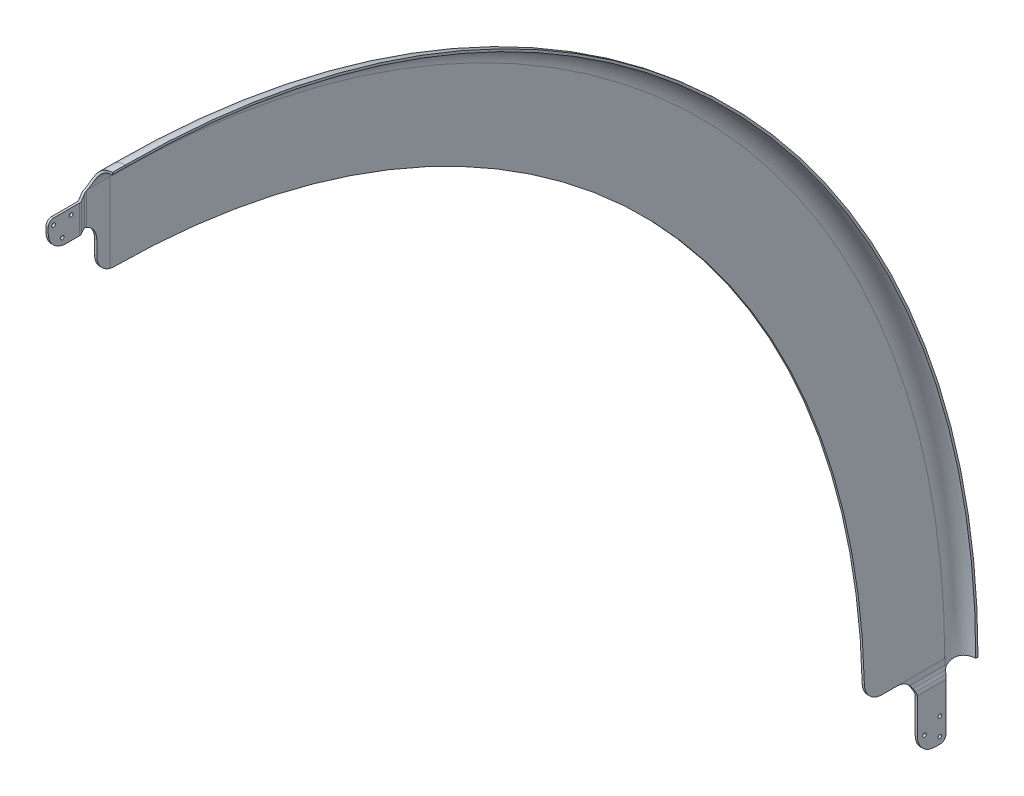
SolidWorks part; units mm, degrees
ref_plane "Front Plane" through (0, 0, 0) normal (1, 0, 0) x (0, 1, 0)
ref_plane "Top Plane" through (0, 0, 0) normal (0, 0, 1) x (0, 1, 0)
ref_plane "Right Plane" through (0, 0, 0) normal (0, 1, 0) x (-1, 0, 0)
sketch "sk 47.8in radi" plane through (0, 0, 0) normal (1, 0, 0) x (0, 1, 0)
  line B0 (-844.7111, -650.1) -> (-379.5689, -650.1)
  line B1 (-844.7111, -648.5125) -> (-379.5689, -648.5125)
  line B2 (844.7111, 574.18) -> (844.7111, 650.1)
  line B3 (843.1236, 574.18) -> (843.1236, 650.1)
  line B4 (843.1236, 650.1) -> (844.7111, 650.1)
  line B5 (-844.7111, -648.5125) -> (-844.7111, -650.1)
  arc B6 (-379.5689, -650.1) -> (844.7111, 574.18) centre (-379.5689, 574.18) ccw
  arc B7 (-379.5689, -648.5125) -> (843.1236, 574.18) centre (-379.5689, 574.18) ccw
  dimension "D1" = 650.1
  dimension "D2" = 844.7111
sketch_block_instance "Block1-1"
sketch_block "Block1" parameters "D1"=1224.28, "D2"=1222.6925, "D4"=1215.2, "D5"=1213.6125, "D3"=1.5875, "D6"=85, "D7"=474.2222
sketch "Curve Path" plane through (0, 0, 0) normal (1, 0, 0) x (0, 1, 0)
  line L0 (-844.7111, -648.5125) -> (-379.5689, -648.5125)
  line L1 (843.1236, 574.18) -> (843.1236, 650.1)
  arc A0 (843.1236, 574.18) -> (-379.5689, -648.5125) centre (-379.5689, 574.18) cw
  arc A1 (-379.5689, -648.5125) -> (843.1236, 574.18) centre (-379.5689, 574.18) ccw construction
ref_plane "Plane Body" through (0, -844.7111, 0) normal (0, 1, 0) x (-1, 0, 0)
sketch "Sketch5"
sketch_block_instance "Block3-3"
sketch_block "Block3" parameters "D1"=25.4, "D2"=16.51, "D3"=61.595, "D4"=243.65
sketch "Body" plane through (0, -844.7111, 0) normal (0, 1, 0) x (-1, 0, 0)
  line L0 (0, -648.5125) -> (92.71, -648.5125) construction
  line L1 (118.11, -623.1125) -> (118.11, -423.9125)
  line L2 (14.605, -398.5125) -> (92.71, -398.5125)
  line L3 (0, -645.3375) -> (92.71, -645.3375) construction
  line L4 (114.935, -623.1125) -> (114.935, -423.9125)
  line L5 (14.605, -401.6875) -> (92.71, -401.6875)
  line L6 (0, -645.3375) -> (0, -648.5125) construction
  line L7 (14.605, -398.5125) -> (14.605, -401.6875)
  line L8 (92.71, -645.3375) -> (92.71, -648.5125)
  arc A0 (118.11, -423.9125) -> (92.71, -398.5125) centre (92.71, -423.9125) ccw
  arc A1 (118.11, -423.9125) -> (92.71, -398.5125) centre (92.71, -423.9125) ccw construction
  arc A2 (92.71, -648.5125) -> (118.11, -623.1125) centre (92.71, -623.1125) ccw
  arc A3 (92.71, -648.5125) -> (118.11, -623.1125) centre (92.71, -623.1125) ccw construction
  arc A4 (92.71, -645.3375) -> (114.935, -623.1125) centre (92.71, -623.1125) ccw
  arc A5 (114.935, -423.9125) -> (92.71, -401.6875) centre (92.71, -423.9125) ccw
  dimension "D1" = 3.175
sweep "Sweep1" add profiles "Body" path "Curve Path"
sketch "Sketch37" plane through (0, 0, 0) normal (1, 0, 0) x (0, 1, 0)
  line L0 (-389.5689, -579.1125) -> (-379.5689, -579.1125)
  line L5 (-379.5689, -579.1125) -> (-379.5689, -340.9051)
  line L7 (-905.0426, -340.9051) -> (-379.5689, -340.9051)
  line L8 (-905.0426, -340.9051) -> (-905.0426, -672.2266)
  line L9 (-905.0426, -672.2266) -> (-379.5689, -672.2266)
  line L10 (-389.5689, -579.1125) -> (-389.5689, -619.9375)
  line L11 (-389.5689, -619.9375) -> (-379.5689, -619.9375)
  line L12 (-379.5689, -619.9375) -> (-379.5689, -672.2266)
  line L13 (-844.7111, -623.1125) -> (-379.5689, -623.1125) construction
  line L14 (-379.5689, -423.9125) -> (-379.5689, -623.1125) construction
  dimension "D2" = 3.175
  dimension "D1" = 10
  dimension "D3" = 40.825
extrude "Cut-Extrude8" cut sketch "Sketch37" against normal through all
sketch "Sketch38" [suppressed] plane through (0, 0, 0) normal (1, 0, 0) x (0, 1, 0)
  line L0 (618.5236, 650.1) -> (817.7236, 650.1) construction
  line L1 (817.7236, 662.9685) -> (879.2961, 662.9685)
  line L2 (817.7236, 662.9685) -> (817.7236, 615.35)
  line L3 (839.7236, 593.35) -> (879.2961, 593.35)
  line L4 (879.2961, 662.9685) -> (879.2961, 593.35)
  line L5 (817.7236, 574.18) -> (817.7236, 650.1) construction
  arc A0 (817.7236, 615.35) -> (839.7236, 593.35) centre (839.7236, 615.35) ccw
  dimension "D2" = 22
  dimension "D1" = 56.75
extrude "Cut-Extrude9" [suppressed] cut sketch "Sketch38" against normal through all
sketch "Sketch39" plane through (0, 0, 0) normal (1, 0, 0) x (0, 1, 0)
  line L9 (-379.5689, -508.1125) -> (-883.7788, -508.1125)
  line L11 (-883.7788, 574.18) -> (-883.7788, -508.1125)
  line L12 (702.7236, 574.18) -> (702.7236, 801.8703)
  line L13 (702.7236, 801.8703) -> (-883.7788, 574.18)
  arc A3 (-379.5689, -423.9125) -> (618.5236, 574.18) centre (-379.5689, 574.18) ccw construction
  arc A8 (-379.5689, -623.1125) -> (817.7236, 574.18) centre (-379.5689, 574.18) ccw construction
  arc A9 (-379.5689, -623.1125) -> (817.7236, 574.18) centre (-379.5689, 574.18) ccw construction
  arc A10 (-379.5689, -508.1125) -> (702.7236, 574.18) centre (-379.5689, 574.18) ccw
  point P5 (326.1891, -131.578)
  point P13 (0, 0)
  point P17 (0, 0)
  point P18 (0, 0)
  point P20 (0, 0)
  point P21 (0, 0)
  point P22 (0, 0)
  point P23 (0, 0)
  point P24 (-379.5689, -508.1125)
  point P25 (0, 0)
  point P26 (0, 0)
  point P29 (-379.5689, -508.1125)
  point P30 (0, 0)
  point P31 (0, 0)
  point P32 (0, 0)
  point P33 (0, 0)
  point P36 (0, 0)
  dimension "D1" = 115
extrude "Cut-Extrude10" cut sketch "Sketch39" against normal through all
sketch "Sketch40" plane through (0, 0, -579.1125) normal (0, 0, 1) x (1, 0, 0)
  line L0 (-118.11, -387.5689) -> (-118.11, -388.8894)
  line L1 (-116.7703, -393.8894) -> (-114.6872, -397.4973)
  line L2 (-113.3475, -402.4973) -> (-113.3475, -477.7889)
  line L3 (-118.11, -389.5689) -> (-118.11, -379.5689) construction
  line L4 (-118.11, -389.5689) -> (-114.935, -389.5689) construction
  line L5 (-118.11, -379.5689) -> (-114.935, -379.5689) construction
  line L6 (-114.935, -387.5689) -> (-114.935, -388.0387)
  line L7 (-113.5953, -393.0387) -> (-111.5122, -396.6465)
  line L8 (-110.1725, -401.6465) -> (-110.1725, -477.7889)
  line L9 (-118.11, -387.5689) -> (-114.935, -387.5689)
  line L10 (-113.3475, -477.7889) -> (-110.1725, -477.7889)
  line L11 (-118.11, -391.5689) -> (-113.3475, -399.8178) construction
  line L12 (-113.3475, -399.8178) -> (-113.3475, -477.7889) construction
  line L13 (-114.935, -387.5689) -> (-114.935, -390.7182) construction
  line L14 (-114.935, -390.7182) -> (-110.1725, -398.9671) construction
  line L15 (-110.1725, -398.9671) -> (-110.1725, -477.7889) construction
  line L16 (-118.11, -387.5689) -> (-118.11, -391.5689) construction
  arc A0 (-114.6872, -397.4973) -> (-113.3475, -402.4973) centre (-123.3475, -402.4973) cw
  arc A1 (-114.935, -388.0387) -> (-113.5953, -393.0387) centre (-104.935, -388.0387) ccw
  arc A2 (-111.5122, -396.6465) -> (-110.1725, -401.6465) centre (-120.1725, -401.6465) cw
  arc A3 (-118.11, -388.8894) -> (-116.7703, -393.8894) centre (-108.11, -388.8894) ccw
  point P2 (0, 0)
  point P7 (0, 0)
  point P10 (0, 0)
  point P18 (0, 0)
  dimension "D7" = 10
  dimension "D1" = 2
  dimension "D2" = 30
  dimension "D3" = 4.7625
  dimension "D5" = 98.22
  dimension "D6" = 3.175
extrude "Boss-Extrude1" add sketch "Sketch40" against normal up to surface (40.825 mm away)
sketch "Sketch41" plane through (-110.1725, 0, 0) normal (1, 0, 0) x (0, 1, 0)
  line L0 (-401.6465, -619.9375) -> (-477.7889, -619.9375) construction
  line L1 (-477.7889, -619.9375) -> (-477.7889, -579.1125) construction
  point P0 (-449.0978, -602.5486)
  line B0 (-468.1889, -611.1125) -> (-455.4889, -589.1155) construction
  line B1 (-455.4889, -589.1155) -> (-442.7889, -611.1125) construction
  line B2 (-442.7889, -611.1125) -> (-468.1889, -611.1125) construction
  circle B3 centre (-468.1889, -611.1125) radius 2.5908
  circle B4 centre (-442.7889, -611.1125) radius 2.5908
  circle B5 centre (-455.4889, -589.1155) radius 2.5908
  line B6 (-455.4889, -611.1125) -> (-455.4889, -603.7802) construction
  dimension "D1" = 8.825
  dimension "D2" = 22.3
sketch_block_instance "Blind Rivet holes-1"
sketch_block "Blind Rivet holes" parameters "D1"=5.1816, "D2"=5.1816, "D3"=5.1816, "D4"=60, "D5"=60, "D6"=25.4, "D7"=25.4, "D8"=25.4
extrude "tab hole 1" cut sketch "Sketch41" against normal blind 10
sketch "Sketch42" plane through (0, 0, 0) normal (1, 0, 0) x (0, 1, 0)
  line L1 (691.0835, 658.2875) -> (847.2702, 658.2875)
  line L2 (691.0835, 658.2875) -> (691.0835, 592.9778)
  line L3 (691.0835, 592.9778) -> (773.7236, 592.9778)
  line L5 (702.7236, 650.1) -> (817.7236, 650.1) construction
  line L8 (814.5486, 592.9778) -> (847.2702, 592.9778)
  line L9 (847.2702, 658.2875) -> (847.2702, 592.9778)
  line L10 (773.7236, 592.9778) -> (773.7236, 607.9778)
  line L11 (773.7236, 607.9778) -> (814.5486, 607.9778)
  line L12 (814.5486, 607.9778) -> (814.5486, 592.9778)
  line L13 (843.1236, 574.18) -> (843.1236, 650.1) construction
  line L14 (702.7236, 574.18) -> (702.7236, 650.1) construction
  line L15 (744.0547, 627.9778) -> (871.9392, 627.9778) construction
  dimension "D1" = 28.575
  dimension "D2" = 71
  dimension "D3" = 20
  dimension "D4" = 22.1222
  dimension "D5" = 15
extrude "Cut-Extrude12" cut sketch "Sketch42" against normal through all
sketch "Sketch43" plane through (0, 773.7236, 0) normal (0, -1, 0) x (1, 0, 0)
  line L0 (-118.11, 606.5357) -> (-118.11, 608.9285)
  line L1 (-117.1722, 612.4285) -> (-111.1103, 622.928)
  line L2 (-110.1725, 626.428) -> (-110.1725, 670.5772)
  line L3 (-118.11, 592.9778) -> (-118.11, 607.9778) construction
  line L4 (-114.935, 606.5357) -> (-114.935, 608.0778)
  line L5 (-113.9972, 611.5778) -> (-107.9353, 622.0772)
  line L6 (-106.9975, 625.5772) -> (-106.9975, 670.5772)
  line L7 (-118.11, 606.5357) -> (-114.935, 606.5357)
  line L8 (-114.935, 609.9534) -> (-106.9975, 623.7016) construction
  line L9 (-106.9975, 623.7016) -> (-106.9975, 670.5772) construction
  line L10 (-118.11, 610.8042) -> (-110.1725, 624.5523) construction
  line L11 (-110.1725, 624.5523) -> (-110.1725, 670.5772) construction
  line L12 (-118.11, 606.5357) -> (-118.11, 610.8042) construction
  line L13 (-114.935, 606.5357) -> (-114.935, 609.9534) construction
  line L14 (-110.1725, 670.5772) -> (-106.9975, 670.5772)
  line L16 (-118.11, 607.9778) -> (-114.935, 607.9778) construction
  arc A0 (-107.9353, 622.0772) -> (-106.9975, 625.5772) centre (-113.9975, 625.5772) ccw
  arc A1 (-111.1103, 622.928) -> (-110.1725, 626.428) centre (-117.1725, 626.428) ccw
  arc A2 (-118.11, 608.9285) -> (-117.1722, 612.4285) centre (-111.11, 608.9285) cw
  arc A3 (-114.935, 608.0778) -> (-113.9972, 611.5778) centre (-107.935, 608.0778) cw
  point P6 (-118.11, 608.5805)
  point P23 (-114.935, 608.2387)
  point P24 (-118.11, 605.4784)
  point P25 (-111.9142, 623.1543)
  point P26 (-107.6674, 624.1403)
  point P27 (-114.935, 607.9778)
  point P28 (-114.935, 608.2218)
  point P29 (-114.935, 608.0432)
  point P30 (0, 0)
  point P31 (-114.935, 608.1218)
  dimension "D5" = 7
  dimension "D1" = 30
  dimension "D2" = 7.9375
  dimension "D3" = 0.1
  dimension "D6" = 45
  dimension "D4" = 3.175
extrude "Boss-Extrude2" add sketch "Sketch43" against normal up to surface (40.825 mm away)
sketch "Sketch44" plane through (-106.9975, 0, 0) normal (1, 0, 0) x (0, 1, 0)
  line L0 (814.5486, 670.5772) -> (814.5486, 625.5772) construction
  line L1 (814.5486, 670.5772) -> (773.7236, 670.5772) construction
  line B0 (805.7236, 637.5778) -> (783.7266, 650.2778) construction
  line B1 (783.7266, 650.2778) -> (805.7236, 662.9778) construction
  line B2 (805.7236, 662.9778) -> (805.7236, 637.5778) construction
  circle B3 centre (805.7236, 637.5778) radius 2.5908
  circle B4 centre (805.7236, 662.9778) radius 2.5908
  circle B5 centre (783.7266, 650.2778) radius 2.5908
  line B6 (805.7236, 650.2778) -> (798.3913, 650.2778) construction
  dimension "D1" = 8.825
  dimension "D2" = 20.2994
sketch_block_instance "Blind Rivet holes-2"
extrude "Cut-Extrude13" cut sketch "Sketch44" against normal through all
fillet "Fillet3" radius 25.4 8 edges at (-116.5225, 702.7236, 592.9778) (-116.5225, -379.5689, -619.9375) (-116.5225, -379.5689, -508.1125) (-116.5225, -379.5689, -579.1125) (-111.76, -477.7889, -579.1125) (-116.5225, 814.5486, 592.9778) (-116.5225, 773.7236, 592.9778) (-108.585, 773.7236, 670.5772)
fillet "Fillet4" radius 8 2 edges at (-108.585, 814.5486, 670.5772) (-111.76, -477.7889, -619.9375)
